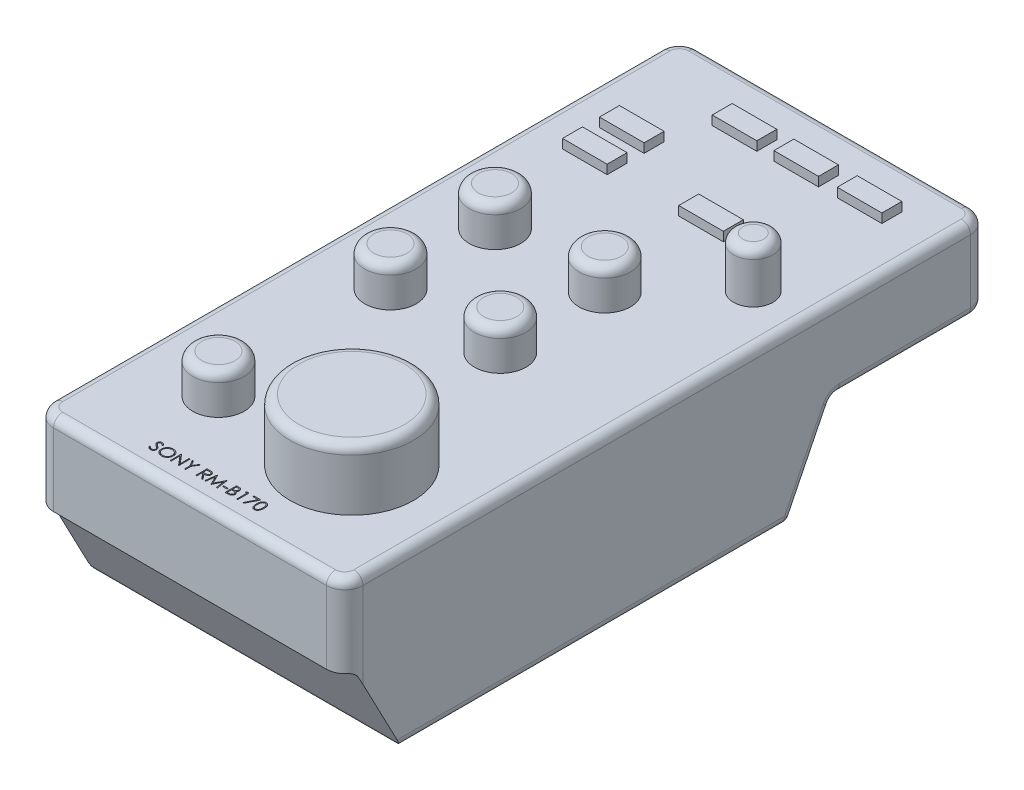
SolidWorks part; units mm, degrees
ref_plane "Front Plane" through (0, 0, 0) normal (0, 0, 1) x (1, 0, 0)
ref_plane "Top Plane" through (0, 0, 0) normal (0, 1, 0) x (1, 0, 0)
ref_plane "Right Plane" through (0, 0, 0) normal (1, 0, 0) x (0, 0, -1)
sketch "Sketch1" plane through (0, 0, 0) normal (0, 1, 0) x (1, 0, 0)
  line L1 (-37.92, 89.5) -> (37.92, 89.5)
  line L2 (-43, 84.42) -> (-43, -84.42)
  line L3 (-37.92, -89.5) -> (37.92, -89.5)
  line L4 (43, 84.42) -> (43, -84.42)
  line L5 (-43, 89.5) -> (43, -89.5) construction
  line L6 (-43, -89.5) -> (43, 89.5) construction
  arc A0 (37.92, -89.5) -> (43, -84.42) centre (37.92, -84.42) ccw
  arc A1 (-43, -84.42) -> (-37.92, -89.5) centre (-37.92, -84.42) ccw
  arc A2 (37.92, 89.5) -> (43, 84.42) centre (37.92, 84.42) cw
  arc A3 (-37.92, 89.5) -> (-43, 84.42) centre (-37.92, 84.42) ccw
  point P0 (0, 0)
  dimension "D3" = 5.08
  dimension "D1" = 86
  dimension "D2" = 179
extrude "Boss-Extrude1" add sketch "Sketch1" along normal blind 47
sketch "Sketch2" plane through (43, 0, 0) normal (1, 0, 0) x (0, 0, -1)
  line L0 (96.2915, 24.3157) -> (46.366, 24.3157)
  line L2 (46.366, 24.3157) -> (34.3568, 0)
  line L3 (-84.42, 0) -> (84.42, 0) construction
  line L4 (-100.0918, 24.3157) -> (-86.3455, 24.3157)
  line L6 (-86.3455, 24.3157) -> (-73.5924, 0)
  line L7 (-73.5924, 0) -> (-73.5924, -10.6514)
  line L8 (-73.5924, -10.6514) -> (-100.0918, -10.6514)
  line L9 (-100.0918, -10.6514) -> (-100.0918, 24.3157)
  line L11 (34.3568, 0) -> (34.3568, -8.0836)
  line L12 (34.3568, -8.0836) -> (96.2915, -8.0836)
  line L13 (96.2915, -8.0836) -> (96.2915, 24.3157)
extrude "Cut-Extrude1" cut sketch "Sketch2" against normal through all
fillet "Fillet1" radius 2.54 21 edges at (43, 12.1578, -40.3614) (-43, 12.1578, -40.3614) (41.5121, 47, 88.0121) (0, 47, 89.5) (-41.5121, 47, 88.0121) (-43, 47, 0) (-41.5121, 47, -88.0121) (0, 47, -89.5) (41.5121, 47, -88.0121) (43, 24.3157, -65.393) (41.5121, 24.3157, -88.0121) (-43, 24.3157, -65.393) (-41.5121, 24.3157, -88.0121) (43, 47, 0) (0, 24.3157, 86.3455) (-43, 0, 19.6178) (43, 0, 19.6178) (0, 0, 73.5924) (0, 24.3157, -89.5) (0, 24.3157, -46.366) (0, 0, -34.3568)
sketch "Sketch3" plane through (0, 47, 0) normal (0, 1, 0) x (1, 0, 0)
  circle A0 centre (14.9535, -59.4817) radius 17.1488
extrude "Boss-Extrude2" add sketch "Sketch3" along normal blind 17
fillet "Fillet2" radius 2.54 1 edges at (14.9535, 64, 76.6305)
hole_wizard "M2.5x0.45 Tapped Hole1" positions "Sketch4" profile "Sketch5" tap size "M2.5x0.45" standard "ANSI Metric"
sketch "Sketch4" plane through (0, 0, 0) normal (0, -1, 0) x (-1, 0, 0)
  line L0 (-28, -63.465) -> (28, -63.465) construction
  line L1 (28, -63.465) -> (28, 22.035) construction
  line L2 (28, 22.035) -> (-28, 22.035) construction
  line L3 (-28, 22.035) -> (-28, -63.465) construction
  line L5 (-43, -74.9246) -> (-43, 32.7784) construction
  line L6 (37.92, -89.5) -> (-37.92, -89.5) construction
  point P0 (28, -63.465)
  point P2 (-28, -63.465)
  point P4 (-28, 22.035)
  point P6 (28, 22.035)
  dimension "D1" = 15
  dimension "D2" = 56
  dimension "D3" = 85.5
  dimension "D4" = 26.035
sketch "Sketch5" plane through (-28, 0, 63.465) normal (1, 0, 0) x (0, 0, -1)
  line L0 (0, 0) -> (0, 7.8803)
  line L1 (0, 7.8803) -> (1.025, 7.2644)
  line L2 (1.025, 7.2644) -> (1.025, 0)
  line L5 (1.025, 0) -> (0, 0)
  line L10 (0, 7.8803) -> (-1.025, 7.2644) construction
  line L11 (0, -6.35) -> (0, 107.95) construction
  dimension "Tap Drill Dia." = 2.05
  dimension "Tap Drill Depth" = 7.2644
  dimension "Drill Angle" = 118
sketch "Sketch6" plane through (0, 47, 0) normal (0, 1, 0) x (1, 0, 0)
  circle A0 centre (-20.0696, -61.5141) radius 7.1682
  circle A1 centre (-22.0276, -11.7481) radius 7.1682
  circle A2 centre (8.4847, -11.7481) radius 7.1682
  circle A3 centre (8.4847, 17.2957) radius 7.1682
  circle A4 centre (-22.0276, 17.2957) radius 7.1682
extrude "Boss-Extrude3" add sketch "Sketch6" along normal blind 10.922
fillet "Fillet3" radius 2.54 5 edges at (-20.0696, 57.922, 68.6823) (8.4847, 57.922, 18.9163) (-22.0276, 57.922, 18.9163) (8.4847, 57.922, -10.1275) (-22.0276, 57.922, -10.1275)
sketch "Sketch7" plane through (0, 47, 0) normal (0, 1, 0) x (1, 0, 0)
  circle A0 centre (28.8806, 38.1812) radius 5.4825
extrude "Boss-Extrude4" add sketch "Sketch7" along normal blind 13.97
fillet "Fillet4" radius 2.54 1 edges at (28.8806, 60.97, -32.6986)
sketch "Sketch8" plane through (0, 47, 0) normal (0, 1, 0) x (1, 0, 0)
  line L0 (30.5123, 77.8308) -> (30.5123, 72.2831)
  line L7 (18.1116, 72.2831) -> (30.5123, 72.2831)
  line L8 (18.1116, 77.8308) -> (30.5123, 72.2831) construction
  line L9 (18.1116, 77.8308) -> (30.5123, 77.8308)
  line L10 (18.1116, 77.8308) -> (18.1116, 72.2831)
  line L11 (18.1116, 72.2831) -> (30.5123, 77.8308) construction
  line L12 (12.8902, 77.8308) -> (12.8902, 72.2831)
  line L13 (0.4895, 72.2831) -> (12.8902, 72.2831)
  line L14 (0.4895, 77.8308) -> (12.8902, 72.2831) construction
  line L15 (0.4895, 77.8308) -> (12.8902, 77.8308)
  line L16 (0.4895, 77.8308) -> (0.4895, 72.2831)
  line L17 (0.4895, 72.2831) -> (12.8902, 77.8308) construction
  line L18 (-4.2424, 77.8308) -> (-4.2424, 72.2831)
  line L19 (-16.6431, 72.2831) -> (-4.2424, 72.2831)
  line L20 (-16.6431, 77.8308) -> (-4.2424, 72.2831) construction
  line L21 (-16.6431, 77.8308) -> (-4.2424, 77.8308)
  line L22 (-16.6431, 77.8308) -> (-16.6431, 72.2831)
  line L23 (-16.6431, 72.2831) -> (-4.2424, 77.8308) construction
  line L24 (-19.4169, 61.6773) -> (-19.4169, 56.1296)
  line L25 (-31.8176, 56.1296) -> (-19.4169, 56.1296)
  line L26 (-31.8176, 61.6773) -> (-19.4169, 56.1296) construction
  line L27 (-31.8176, 61.6773) -> (-19.4169, 61.6773)
  line L28 (-31.8176, 61.6773) -> (-31.8176, 56.1296)
  line L29 (-31.8176, 56.1296) -> (-19.4169, 61.6773) construction
  line L30 (-19.4169, 51.3977) -> (-19.4169, 45.85)
  line L31 (-31.8176, 45.85) -> (-19.4169, 45.85)
  line L32 (-31.8176, 51.3977) -> (-19.4169, 45.85) construction
  line L33 (-31.8176, 51.3977) -> (-19.4169, 51.3977)
  line L34 (-31.8176, 51.3977) -> (-31.8176, 45.85)
  line L35 (-31.8176, 45.85) -> (-19.4169, 51.3977) construction
  line L42 (12.8902, 51.3977) -> (12.8902, 45.85)
  line L43 (0.4895, 45.85) -> (12.8902, 45.85)
  line L44 (0.4895, 51.3977) -> (12.8902, 45.85) construction
  line L45 (0.4895, 51.3977) -> (12.8902, 51.3977)
  line L46 (0.4895, 51.3977) -> (0.4895, 45.85)
  line L47 (0.4895, 45.85) -> (12.8902, 51.3977) construction
  point P5 (24.3119, 75.057)
  point P10 (6.6899, 75.057)
  point P15 (-10.4427, 75.057)
  point P20 (-25.6173, 58.9034)
  point P25 (-25.6173, 48.6239)
  point P35 (6.6899, 48.6239)
extrude "Boss-Extrude5" add sketch "Sketch8" along normal blind 2.54
sketch "Sketch9" plane through (0, 47, 0) normal (0, 1, 0) x (1, 0, 0)
  text T0 "SONY RM-B170"
  point P1 (-2.1952, -59.4817)
  point P2 (-21.7013, -83.0522)
  point P3 (0, 0)
  point P4 (-17.7852, -83.7049)
  point P6 (3.5166, -46.7038)
extrude "Cut-Extrude2" cut sketch "Sketch9" against normal blind 1.27
